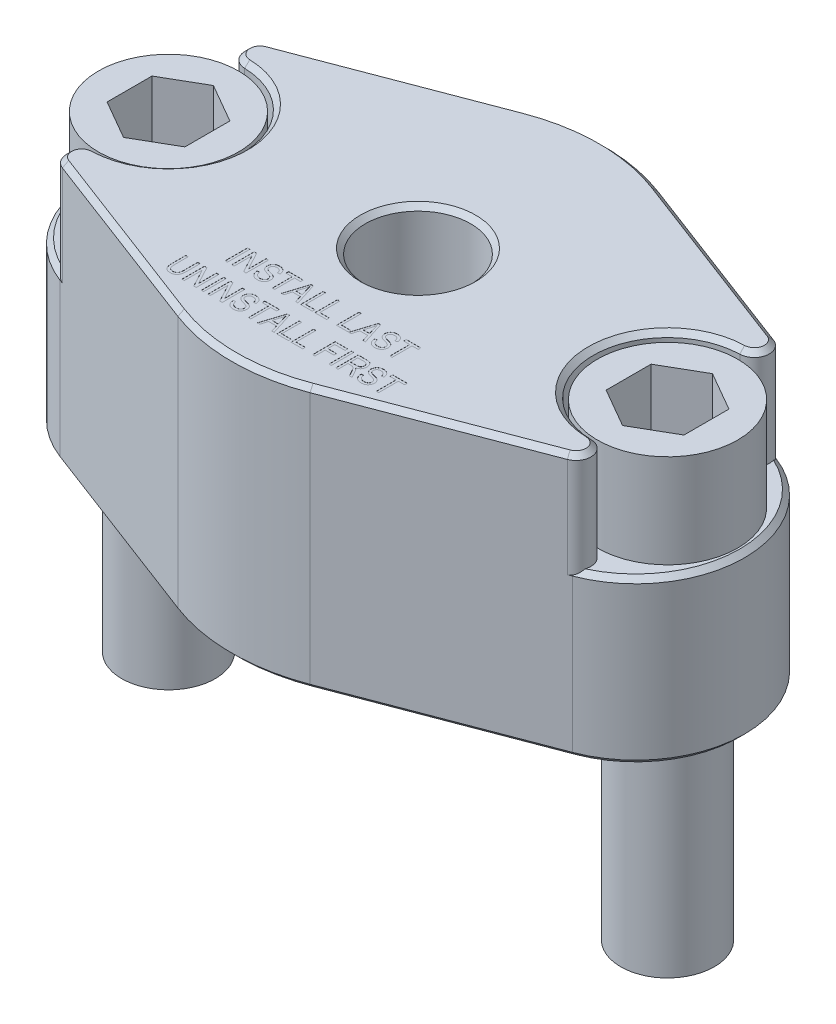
SolidWorks part; units mm, degrees
other "<SHCS37-16L1.50>-<HEX>"
ref_plane "Front Plane" through (0, 0, 0) normal (0, 0, 1) x (1, 0, 0)
ref_plane "Top Plane" through (0, 0, 0) normal (0, 1, 0) x (1, 0, 0)
ref_plane "Right Plane" through (0, 0, 0) normal (1, 0, 0) x (0, 0, -1)
sketch "Sketch1" plane through (0, 0, 0) normal (0, 1, 0) x (1, 0, 0)
  line L0 (-6.7324, 17.7121) -> (-26.0962, 10.3518)
  line L1 (-26.0962, -10.3518) -> (-6.7324, -17.7121)
  line L2 (6.7324, -17.7121) -> (26.0962, -10.3518)
  line L3 (26.0962, 10.3518) -> (6.7324, 17.7121)
  line L4 (-22.1615, 0) -> (22.1615, 0) construction
  line L5 (0, 0) -> (0, 22.9186) construction
  arc A0 (-6.7324, -17.7121) -> (6.7324, -17.7121) centre (0, 0) ccw
  arc A1 (-26.0962, 10.3518) -> (-26.0962, -10.3518) centre (-22.1615, 0) ccw
  arc A2 (26.0962, -10.3518) -> (26.0962, 10.3518) centre (22.1615, 0) ccw
  arc A3 (6.7324, 17.7121) -> (-6.7324, 17.7121) centre (0, 0) ccw
  circle A4 centre (-25.4, 0) radius 5.1435
  circle A5 centre (25.4, 0) radius 5.1435
  dimension "D1" = 37.8968
  dimension "D2" = 11.0744
  dimension "D3" = 66.4718
  dimension "D5" = 25.4
  dimension "D6" = 10.287
  dimension "D4" = 20.812
extrude "Boss-Extrude1" add sketch "Sketch1" along normal blind 26.7208
sketch "Sketch2" plane through (0, 0, 0) normal (0, -1, 0) x (1, 0, 0)
  circle A0 centre (0, 0) radius 16.002
  dimension "D1" = 32.004
extrude "Cut-Extrude1" cut sketch "Sketch2" against normal blind 12.7
fillet "Fillet1" radius 0.508 1 edges at (0, 12.7, -16.002)
sketch "Sketch3" plane through (0, 26.7208, 0) normal (0, 1, 0) x (1, 0, 0)
  line L0 (-25.4, 7.5565) -> (-33.2359, 7.5565)
  line L1 (-33.2359, 7.5565) -> (-33.2359, -7.5565)
  line L2 (-33.2359, -7.5565) -> (-25.4, -7.5565)
  line L3 (25.4, 7.5565) -> (33.2359, 7.5565)
  line L4 (33.2359, 7.5565) -> (33.2359, -7.5565)
  line L5 (33.2359, -7.5565) -> (25.4, -7.5565)
  arc A0 (-25.4, -7.5565) -> (-25.4, 7.5565) centre (-25.4, 0) ccw
  arc A1 (25.4, 7.5565) -> (25.4, -7.5565) centre (25.4, 0) ccw
  arc A2 (-26.0962, 10.3518) -> (-26.0962, -10.3518) centre (-22.1615, 0) ccw construction
  arc A3 (26.0962, -10.3518) -> (26.0962, 10.3518) centre (22.1615, 0) ccw construction
  dimension "D1" = 15.113
extrude "Cut-Extrude2" cut sketch "Sketch3" against normal blind 10.16
hole_wizard "1/2-13 Tapped Hole1" positions "Sketch4" profile "Sketch5" tap size "1/2-13" standard "ANSI Inch"
sketch "Sketch4" plane through (0, 26.7208, 0) normal (0, 1, 0) x (1, 0, 0)
  point P0 (0, 0)
sketch "Sketch5" plane through (0, 26.7208, 0) normal (1, 0, 0) x (0, 0, 1)
  line L0 (0, 0) -> (0, 26.7208)
  line L1 (0, 26.7208) -> (5.3581, 26.7208)
  line L2 (5.3581, 26.7208) -> (5.3581, 0)
  line L5 (5.3581, 0) -> (0, 0)
  line L11 (0, -6.35) -> (0, 107.95) construction
  dimension "Thru Tap Drill Dia." = 10.7163
  dimension "Thru Tap Drill Depth" = 26.7208
fillet "Fillet2" radius 1.524 4 edges at (30.2573, 21.6408, -7.5565) (30.2573, 21.6408, 7.5565) (-30.2573, 21.6408, 7.5565) (-30.2573, 21.6408, -7.5565)
chamfer "Chamfer1" distance 0.508 angle 45 30 edges at (16.2169, 26.7208, -14.107) (16.2169, 26.7208, 14.107) (0, 26.7208, 18.9484) (-16.2169, 26.7208, 14.107) (-16.2169, 26.7208, -14.107) (0, 26.7208, -18.9484) (17.8435, 26.7208, 0) (-17.8435, 26.7208, 0) (0, 26.7208, 5.3581) (25.4, 0, 5.1435) (0, 0, -16.002) (-25.4, 0, 5.1435) (16.4143, 0, -14.0319) (0, 0, -18.9484) (33.2359, 0, 0) (-16.4143, 0, -14.0319) (16.4143, 0, 14.0319) (-33.2359, 0, 0) (0, 0, 18.9484) (-16.4143, 0, 14.0319) (26.6624, 26.7208, 8.8219) (-26.6624, 26.7208, 8.8219) (-26.6624, 26.7208, -8.8219) (26.6624, 26.7208, -8.8219) (25.8988, 16.5608, 10.4269) (25.8988, 16.5608, -10.4269) (33.2359, 16.5608, 0) (-25.8988, 16.5608, -10.4269) (-25.8988, 16.5608, 10.4269) (-33.2359, 16.5608, 0)
sketch "Sketch6" plane through (0, 26.7208, 0) normal (0, 1, 0) x (1, 0, 0)
  line L0 (-12.7, -10.922) -> (12.7, -10.922) construction
  line L1 (0, 18.4404) -> (0, -18.9484) construction
  line L3 (-12.7, -14.732) -> (12.7, -14.732) construction
  arc A0 (6.5519, 17.2372) -> (-6.5519, 17.2372) centre (0, 0) ccw construction
  arc A1 (-6.7324, -17.7121) -> (6.7324, -17.7121) centre (0, 0) ccw construction
  text T0 "INSTALL LAST" font "Arial Narrow" height 2.286
  text T2 "UNINSTALL FIRST" font "Arial Narrow" height 2.286
  point P14 (0, -10.922)
  dimension "D2" = 25.4
  dimension "D5" = 10.922
  dimension "D6" = 14.732
extrude "Cut-Extrude3" cut sketch "Sketch6" against normal blind 0.0127
inserted part "SHCS37-16L1.50"
move or copy body "Body-Move/Copy2" placed by mates yes parameters "D1"=0, "D2"=0, "D3"=0
mirror "Mirror1" about plane through (0, 0, 0) normal (1, 0, 0)
